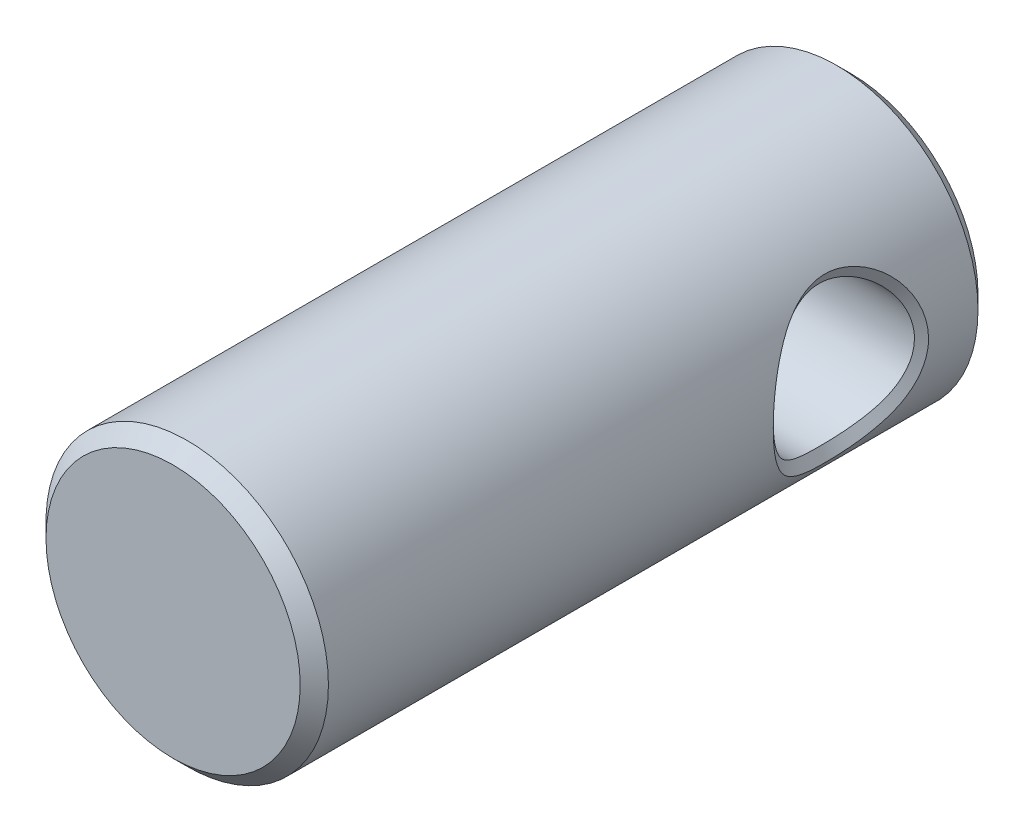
SolidWorks part; units mm, degrees
ref_plane "Plan de face" through (0, 0, 0) normal (0, 0, 1) x (1, 0, 0)
ref_plane "Plan de dessus" through (0, 0, 0) normal (0, 1, 0) x (1, 0, 0)
ref_plane "Plan de droite" through (0, 0, 0) normal (1, 0, 0) x (0, 0, -1)
sketch "Esquisse1" plane through (0, 0, 0) normal (0, 0, 1) x (1, 0, 0)
  circle A0 centre (0, 0) radius 10
  dimension "D1" = 20
extrude "Extrusion1" add sketch "Esquisse1" along normal blind 48
chamfer "Chanfrein1" distance 1 angle 45 2 edges at (10, 0, 48) (10, 0, 0)
sketch "Esquisse2" plane through (0, 0, 0) normal (1, 0, 0) x (0, 0, -1)
  line L0 (-48, 9) -> (-48, -9) construction
  circle A0 centre (-10, 0) radius 5
  dimension "D1" = 10
  dimension "D2" = 10
extrude "Enlèv. mat.-Extru.1" cut sketch "Esquisse2" against normal mid plane 33
chamfer "Chanfrein2" distance 0.5 angle 45 2 edges at (-9.9873, 0.5045, 5.0255) (9.9873, 0.5045, 14.9745)
